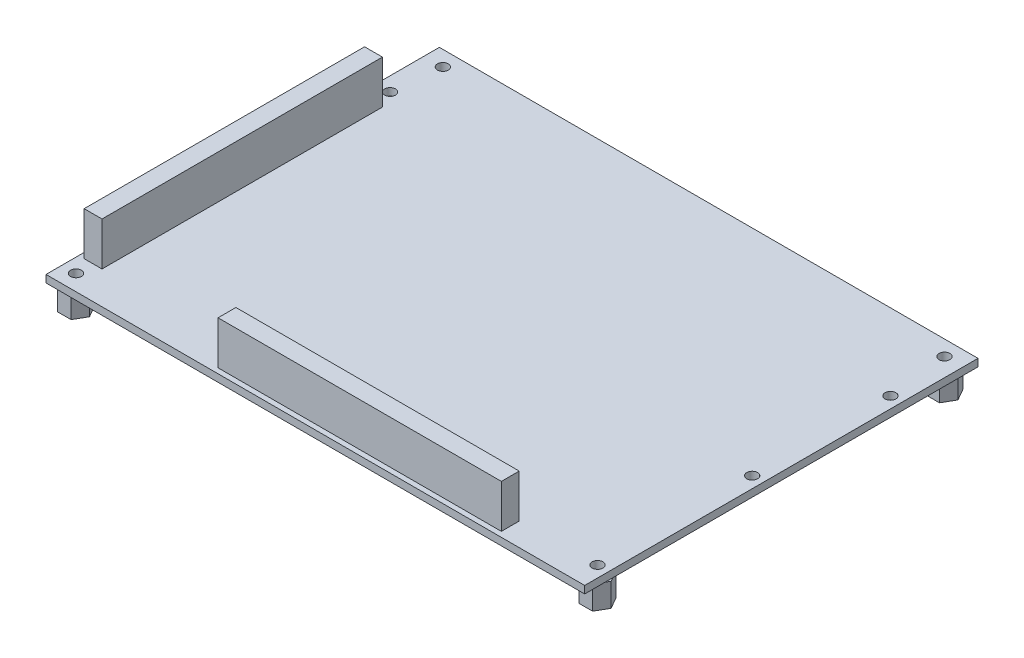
SolidWorks part; units mm, degrees
ref_plane "Front Plane" through (0, 0, 0) normal (0, 0, 1) x (1, 0, 0)
ref_plane "Top Plane" through (0, 0, 0) normal (0, 1, 0) x (1, 0, 0)
ref_plane "Right Plane" through (0, 0, 0) normal (1, 0, 0) x (0, 0, -1)
sketch "Sketch1" plane through (0, 0, 0) normal (0, 1, 0) x (1, 0, 0)
  line L0 (0, 92.5957) -> (0, 106.5657)
  line L1 (0, 0) -> (145.9357, 0)
  line L2 (0, 0) -> (0, 92.5957)
  line L3 (0, 92.5957) -> (145.9357, 92.5957) construction
  line L4 (145.9357, 0) -> (145.9357, 92.5957)
  line L5 (0, 106.5657) -> (145.9357, 106.5657)
  line L6 (145.9357, 106.5657) -> (145.9357, 92.5957)
  circle A0 centre (3.81, 89.408) radius 1.4732
  circle A1 centre (3.81, 4.318) radius 1.4732
  circle A2 centre (142.875, 85.9155) radius 1.4732
  circle A3 centre (142.875, 48.4505) radius 1.4732
  circle A4 centre (5.08, 102.4382) radius 1.4732
  circle A5 centre (140.97, 102.4382) radius 1.4732
  circle A6 centre (142.875, 6.5532) radius 1.4732
  dimension "D3" = 2.9464
  dimension "D1" = 145.9357
  dimension "D2" = 92.5957
  dimension "D4" = 3.81
  dimension "D5" = 89.408
  dimension "D6" = 4.318
  dimension "D7" = 142.875
  dimension "D8" = 85.9155
  dimension "D9" = 48.4505
  dimension "D10" = 13.97
  dimension "D11" = 9.8425
  dimension "D12" = 5.08
  dimension "D13" = 140.97
  dimension "D14" = 86.0425
extrude "Extrude1" add sketch "Sketch1" along normal blind 2.0066
sketch "Sketch3" plane through (0, 2.0066, 0) normal (0, -1, 0) x (1, 0, 0)
  line L0 (145.9357, 0) -> (145.9357, -106.5657) construction
  line L1 (45.212, -1.397) -> (121.9708, -1.397)
  line L2 (45.212, -1.397) -> (45.212, -6.2357)
  line L3 (45.212, -6.2357) -> (121.9708, -6.2357)
  line L4 (121.9708, -1.397) -> (121.9708, -6.2357)
  line L6 (0, -106.5657) -> (0, 0) construction
  line L7 (1.4732, -8.8646) -> (6.3119, -8.8646)
  line L8 (1.4732, -8.8646) -> (1.4732, -84.836)
  line L9 (1.4732, -84.836) -> (6.3119, -84.836)
  line L10 (6.3119, -8.8646) -> (6.3119, -84.836)
  line L11 (0, 0) -> (125.9974, 0) construction
  dimension "D1" = 23.9649
  dimension "D2" = 76.7588
  dimension "D3" = 1.397
  dimension "D4" = 4.8387
  dimension "D5" = 1.4732
  dimension "D6" = 75.9714
  dimension "D7" = 8.8646
extrude "Extrude3" add sketch "Sketch3" against normal blind 11.7348
sketch "Sketch4" plane through (0, 0, 0) normal (0, -1, 0) x (1, 0, 0)
  line L0 (0, 0) -> (145.9357, 0) construction
  line L1 (5.6431, -7.493) -> (7.4762, -4.318)
  line L2 (7.4762, -4.318) -> (5.6431, -1.143)
  line L3 (5.6431, -1.143) -> (1.9769, -1.143)
  line L4 (1.9769, -1.143) -> (0.1438, -4.318)
  line L5 (0.1438, -4.318) -> (1.9769, -7.493)
  line L6 (1.9769, -7.493) -> (5.6431, -7.493)
  line L7 (145.9357, -106.5657) -> (0, -106.5657) construction
  line L8 (141.0419, -9.7282) -> (144.7081, -9.7282)
  line L9 (144.7081, -9.7282) -> (146.5412, -6.5532)
  line L10 (146.5412, -6.5532) -> (144.7081, -3.3782)
  line L11 (144.7081, -3.3782) -> (141.0419, -3.3782)
  line L12 (141.0419, -3.3782) -> (139.2088, -6.5532)
  line L13 (139.2088, -6.5532) -> (141.0419, -9.7282)
  line L14 (144.6362, -102.4382) -> (142.8031, -99.2632)
  line L15 (142.8031, -99.2632) -> (139.1369, -99.2632)
  line L16 (139.1369, -99.2632) -> (137.3038, -102.4382)
  line L17 (137.3038, -102.4382) -> (139.1369, -105.6132)
  line L18 (139.1369, -105.6132) -> (142.8031, -105.6132)
  line L19 (142.8031, -105.6132) -> (144.6362, -102.4382)
  line L20 (8.7462, -102.4382) -> (6.9131, -99.2632)
  line L21 (6.9131, -99.2632) -> (3.2469, -99.2632)
  line L22 (3.2469, -99.2632) -> (1.4138, -102.4382)
  line L23 (1.4138, -102.4382) -> (3.2469, -105.6132)
  line L24 (3.2469, -105.6132) -> (6.9131, -105.6132)
  line L25 (6.9131, -105.6132) -> (8.7462, -102.4382)
  line L26 (145.9357, -106.5657) -> (0, -106.5657) construction
  circle A0 centre (3.81, -4.318) radius 3.175 construction
  circle A1 centre (142.875, -6.5532) radius 2.5517 construction
  circle A2 centre (3.81, -4.318) radius 1.4732 construction
  circle A3 centre (3.81, -4.318) radius 1.4732
  circle A4 centre (3.81, -4.318) radius 1.4732 construction
  circle A5 centre (142.875, -6.5532) radius 1.4732 construction
  circle A6 centre (140.97, -102.4382) radius 3.175 construction
  circle A7 centre (5.08, -102.4382) radius 1.4732 construction
  circle A8 centre (5.08, -102.4382) radius 2.5517 construction
  circle A9 centre (5.08, -102.4382) radius 1.4732
  circle A10 centre (142.875, -6.5532) radius 1.4732
  circle A11 centre (142.875, -6.5532) radius 1.4732 construction
  circle A13 centre (140.97, -102.4382) radius 1.4732 construction
  circle A14 centre (140.97, -102.4382) radius 1.4732
  dimension "D1" = 6.35
  dimension "D2" = 6.35
  dimension "D3" = 6.35
  dimension "D4" = 6.35
extrude "Extrude4" add sketch "Sketch4" along normal blind 6.35
sketch "Sketch5" plane through (0, -6.35, 0) normal (0, -1, 0) x (1, 0, 0)
  circle A0 centre (3.81, -4.318) radius 1.4732 construction
  circle A1 centre (142.875, -6.5532) radius 1.4732 construction
  circle A2 centre (140.97, -102.4382) radius 1.4688 construction
  circle A3 centre (5.08, -102.4382) radius 1.4732 construction
